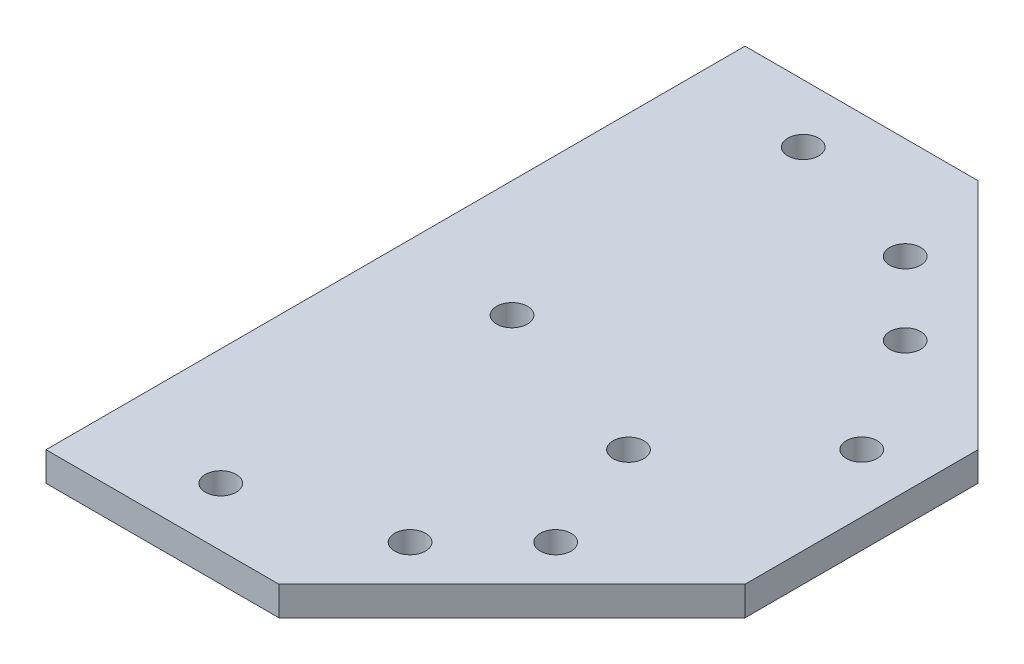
SolidWorks part; units mm, degrees
ref_plane "Front" through (0, 0, 0) normal (0, 0, 1) x (1, 0, 0)
ref_plane "Top" through (0, 0, 0) normal (0, 1, 0) x (1, 0, 0)
ref_plane "Right" through (0, 0, 0) normal (1, 0, 0) x (0, 0, -1)
sketch "Sketch1" plane through (0, 0, 0) normal (0, 1, 0) x (1, 0, 0)
  line L0 (0, 25.4) -> (101.6, 25.4) construction
  line L1 (101.6, 0) -> (50.8, -50.8)
  line L2 (0, 0) -> (0, 50.8)
  line L3 (101.6, 50.8) -> (50.8, 101.6)
  line L4 (101.6, 0) -> (101.6, 50.8)
  line L5 (38.1, 38.1) -> (118.3211, 38.1) construction
  line L6 (25.4, 12.7) -> (118.4547, 12.7) construction
  line L7 (25.4, 12.7) -> (25.4, 113.7115) construction
  line L9 (0, 50.8) -> (0, 101.6)
  line L10 (0, 101.6) -> (50.8, 101.6)
  line L13 (0, 0) -> (0, -50.8)
  line L14 (0, -50.8) -> (50.8, -50.8)
  circle A0 centre (73.025, -12.7) radius 3.3731
  circle A1 centre (57.15, -28.575) radius 3.3731
  circle A2 centre (88.9, 38.1534) radius 3.3731
  circle A3 centre (63.5, 12.7) radius 3.3731
  circle A4 centre (25.4, 88.9) radius 3.3731
  circle A5 centre (25.4, -38.1) radius 3.3731
  circle A6 centre (25.4, 25.4) radius 3.3731
  circle A7 centre (73.025, 63.5) radius 3.3731
  circle A8 centre (57.15, 79.375) radius 3.3731
  dimension "D3" = 38.1
  dimension "D8" = 12.7
  dimension "D9" = 25.4
  dimension "D12" = 12.7
  dimension "D1" = 50.8
  dimension "D2" = 101.6
  dimension "D4" = 53.975
  dimension "D5" = 28.575
  dimension "D6" = 44.45
  dimension "D10" = 50.8
  dimension "D11" = 50.8
extrude "Extrude1" add sketch "Sketch1" along normal blind 6.35
